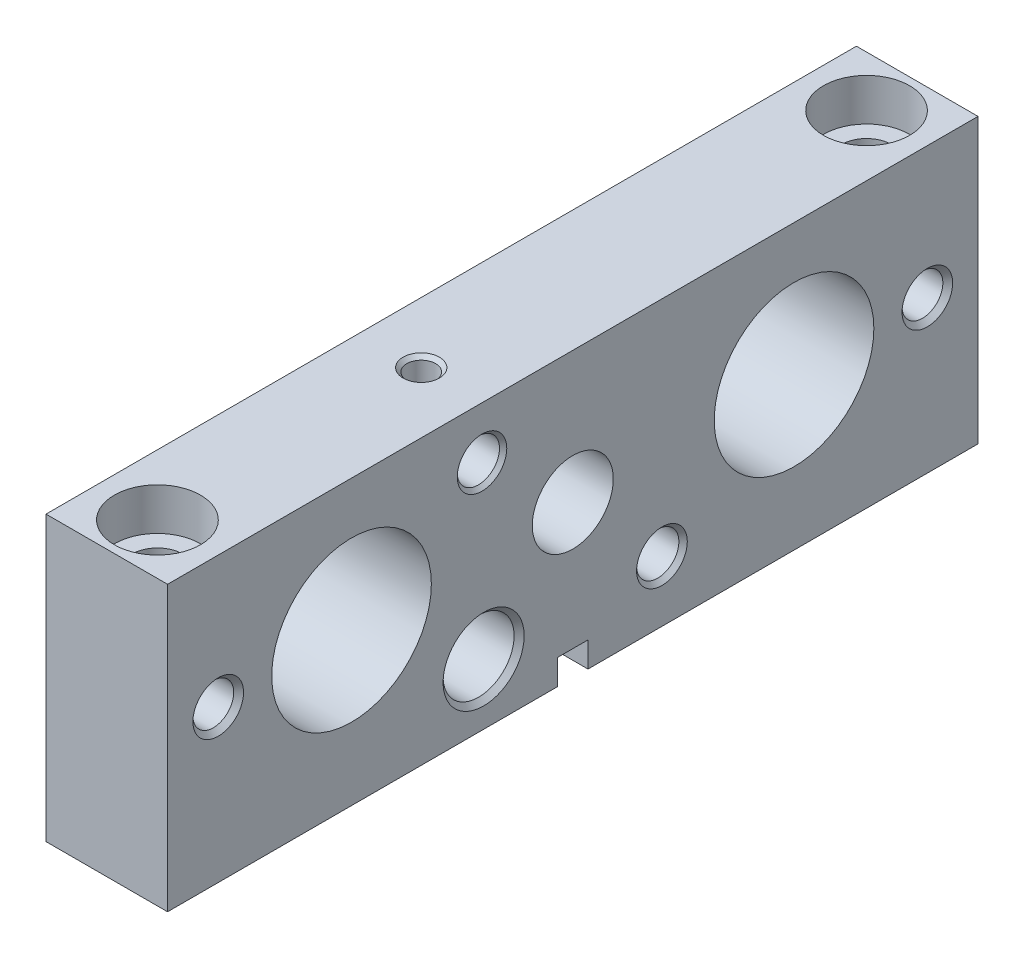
SolidWorks part; units mm, degrees
ref_plane "Front Plane" through (0, 0, 0) normal (0, 0, 1) x (1, 0, 0)
ref_plane "Top Plane" through (0, 0, 0) normal (0, 1, 0) x (1, 0, 0)
ref_plane "Right Plane" through (0, 0, 0) normal (1, 0, 0) x (0, 0, -1)
sketch "Sketch1" plane through (0, 0, 0) normal (1, 0, 0) x (0, 0, -1)
  line L0 (-63.5, -23.8252) -> (-2.3838, -23.8252)
  line L1 (-2.3838, -23.8252) -> (-2.3838, -19.8628)
  line L2 (-2.3838, -19.8628) -> (2.3838, -19.8628)
  line L3 (2.3838, -19.8628) -> (2.3838, -23.8252)
  line L4 (2.3838, -23.8252) -> (63.5, -23.8252)
  line L5 (63.5, -23.8252) -> (63.5, 20.6248)
  line L6 (63.5, 20.6248) -> (-63.5, 20.6248)
  line L7 (-63.5, 20.6248) -> (-63.5, -23.8252)
extrude "Extrude1" add sketch "Sketch1" along normal blind 19.05
ref_plane "Plane1" through (0, -23.8252, 0) normal (0, 1, 0) x (-1, 0, 0)
ref_plane "Plane2" through (0, -19.8628, 0) normal (0, 1, 0) x (-1, 0, 0)
sketch "Sketch2" plane through (0, -19.8628, 0) normal (0, 1, 0) x (-1, 0, 0)
  circle A0 centre (-9.525, 0) radius 2.3838
extrude "Cut-Extrude1" cut sketch "Sketch2" along normal blind 6.35
ref_plane "Plane3" through (0, -14.3002, 0) normal (0, 1, 0) x (-1, 0, 0)
sketch "Sketch3" plane through (0, -14.3002, 0) normal (0, 1, 0) x (-1, 0, 0)
  line L0 (-19.05, -13.97) -> (-19.05, -9.9949)
  line L1 (-19.05, -9.9949) -> (-18.3896, -10.6553)
  line L2 (-18.3896, -10.6553) -> (-0.6604, -10.6553)
  line L3 (-0.6604, -10.6553) -> (0, -9.9949)
  line L4 (0, -9.9949) -> (0, -13.97)
  line L5 (0, -13.97) -> (-19.05, -13.97)
  line L6 (0, -13.97) -> (-19.05, -13.97) construction
revolve "Cut-Revolve1" cut sketch "Sketch3" angle 360 about L6
ref_plane "Plane4" through (0, -14.3002, 0) normal (0, 1, 0) x (-1, 0, 0)
sketch "Sketch4" plane through (0, -14.3002, 0) normal (0, 1, 0) x (-1, 0, 0)
  line L0 (-19.05, 13.97) -> (-19.05, 20.32)
  line L1 (-19.05, 20.32) -> (-18.2626, 19.5326)
  line L2 (-18.2626, 19.5326) -> (-0.7874, 19.5326)
  line L3 (-0.7874, 19.5326) -> (0, 20.32)
  line L4 (0, 20.32) -> (0, 13.97)
  line L5 (0, 13.97) -> (-19.05, 13.97)
  line L6 (0, 13.97) -> (-19.05, 13.97) construction
revolve "Cut-Revolve2" cut sketch "Sketch4" angle 360 about L6
ref_plane "Plane5" through (0, 12.4968, 0) normal (0, 1, 0) x (-1, 0, 0)
sketch "Sketch5" plane through (0, 12.4968, 0) normal (0, 1, 0) x (-1, 0, 0)
  line L0 (-19.05, 14.224) -> (-19.05, 18.104)
  line L1 (-19.05, 18.104) -> (-18.4795, 17.5335)
  line L2 (-18.4795, 17.5335) -> (-0.5705, 17.5335)
  line L3 (-0.5705, 17.5335) -> (0, 18.104)
  line L4 (0, 18.104) -> (0, 14.224)
  line L5 (0, 14.224) -> (-19.05, 14.224)
  line L6 (0, 14.224) -> (-19.05, 14.224) construction
revolve "Cut-Revolve3" cut sketch "Sketch5" angle 360 about L6
ref_plane "Plane6" through (0, 0, 55.5625) normal (0, 0, 1) x (1, 0, 0)
ref_plane "Plane7" through (0, 0, -55.5625) normal (0, 0, 1) x (1, 0, 0)
sketch "Sketch6" plane through (0, 0, -55.5625) normal (0, 0, 1) x (1, 0, 0)
  line L0 (9.525, 20.6248) -> (16.2725, 20.6248)
  line L1 (16.2725, 20.6248) -> (16.2725, 14.0208)
  line L2 (16.2725, 14.0208) -> (13.4938, 14.0208)
  line L3 (13.4938, 14.0208) -> (13.4938, -23.8252)
  line L4 (13.4938, -23.8252) -> (9.525, -23.8252)
  line L5 (9.525, -23.8252) -> (9.525, 20.6248)
  line L6 (9.525, -23.8252) -> (9.525, 20.6248) construction
revolve "Cut-Revolve4" cut sketch "Sketch6" angle 360 about L6
sketch "Sketch7" plane through (0, 0, 55.5625) normal (0, 0, 1) x (1, 0, 0)
  line L0 (9.525, 20.6248) -> (16.2725, 20.6248)
  line L1 (16.2725, 20.6248) -> (16.2725, 14.0208)
  line L2 (16.2725, 14.0208) -> (13.4938, 14.0208)
  line L3 (13.4938, 14.0208) -> (13.4938, -23.8252)
  line L4 (13.4938, -23.8252) -> (9.525, -23.8252)
  line L5 (9.525, -23.8252) -> (9.525, 20.6248)
  line L6 (9.525, -23.8252) -> (9.525, 20.6248) construction
revolve "Cut-Revolve5" cut sketch "Sketch7" angle 360 about L6
ref_plane "Plane8" through (0, 0, -31.75) normal (0, 0, 1) x (1, 0, 0)
ref_plane "Plane9" through (0, 0, -25.4) normal (0, 0, 1) x (1, 0, 0)
ref_plane "Plane10" through (0, 0, 13.97) normal (0, 0, 1) x (1, 0, 0)
ref_plane "Plane11" through (0, 0, 13.4874) normal (0, 0, 1) x (1, 0, 0)
ref_plane "Plane12" through (0, 0, 14.224) normal (0, 0, 1) x (1, 0, 0)
sketch "Sketch8" plane through (0, 0, 14.224) normal (0, 0, 1) x (1, 0, 0)
  line L0 (9.525, 20.6248) -> (12.3698, 20.6248)
  line L1 (12.3698, 20.6248) -> (11.7856, 20.0406)
  line L2 (11.7856, 20.0406) -> (11.7856, 16.256)
  line L3 (11.7856, 16.256) -> (9.525, 14.9508)
  line L4 (9.525, 14.9508) -> (9.525, 20.6248)
  line L5 (9.525, 14.9508) -> (9.525, 20.6248) construction
revolve "Cut-Revolve6" cut sketch "Sketch8" angle 360 about L5
ref_plane "Plane13" through (0, 0, 0) normal (1, 0, 0) x (0, 0, -1)
ref_plane "Plane14" through (9.525, 0, 0) normal (1, 0, 0) x (0, 0, -1)
ref_plane "Plane15" through (0, 0, 0) normal (0, 1, 0) x (-1, 0, 0)
sketch "Sketch9" plane through (0, 0, 0) normal (0, 1, 0) x (-1, 0, 0)
  line L0 (-19.05, 34.671) -> (-19.05, 47.1805)
  line L1 (-19.05, 47.1805) -> (0, 47.1805)
  line L2 (0, 47.1805) -> (0, 34.671)
  line L3 (0, 34.671) -> (-19.05, 34.671)
  line L4 (0, 34.671) -> (-19.05, 34.671) construction
sketch "Sketch10" plane through (0, 0, 0) normal (0, 1, 0) x (-1, 0, 0)
  line L0 (-19.05, -34.671) -> (-19.05, -22.1615)
  line L1 (-19.05, -22.1615) -> (0, -22.1615)
  line L2 (0, -22.1615) -> (0, -34.671)
  line L3 (0, -34.671) -> (-19.05, -34.671)
  line L4 (0, -34.671) -> (-19.05, -34.671) construction
revolve "Cut-Revolve7" cut sketch "Sketch9" angle 360 about L4
revolve "Cut-Revolve8" cut sketch "Sketch10" angle 360 about L4
sketch "Sketch11" plane through (0, 0, 0) normal (0, 1, 0) x (-1, 0, 0)
  line L0 (0, 0) -> (0, -5.1318)
  line L1 (0, -5.1318) -> (-0.6004, -4.5313)
  line L2 (-0.6004, -4.5313) -> (-9.525, -4.2524)
  line L3 (-9.525, -4.2524) -> (-9.525, -6.35)
  line L4 (-9.525, -6.35) -> (-19.05, -6.35)
  line L5 (-19.05, -6.35) -> (-19.05, 0)
  line L6 (-19.05, 0) -> (0, 0)
  line L7 (-19.05, 0) -> (0, 0) construction
revolve "Cut-Revolve9" cut sketch "Sketch11" angle 360 about L7
ref_plane "Plane16" through (19.05, 0, 0) normal (1, 0, 0) x (0, 0, -1)
ref_plane "Plane17" through (19.05, 0, 0) normal (1, 0, 0) x (0, 0, -1)
ref_plane "Plane18" through (0, 0, 0) normal (1, 0, 0) x (0, 0, -1)
ref_plane "Plane19" through (0, 0, 0) normal (0, 1, 0) x (-1, 0, 0)
sketch "Sketch12" plane through (0, 0, 0) normal (0, 1, 0) x (-1, 0, 0)
  line L0 (-19.05, -55.5625) -> (-19.05, -51.5938)
  line L1 (-19.05, -51.5938) -> (-18.2816, -52.3621)
  line L2 (-18.2816, -52.3621) -> (-0.7683, -52.3621)
  line L3 (-0.7683, -52.3621) -> (0, -51.5938)
  line L4 (0, -51.5938) -> (0, -55.5625)
  line L5 (0, -55.5625) -> (-19.05, -55.5625)
  line L6 (0, -55.5625) -> (-19.05, -55.5625) construction
sketch "Sketch13" plane through (0, 0, 0) normal (0, 1, 0) x (-1, 0, 0)
  line L0 (-19.05, 55.5625) -> (-19.05, 59.5312)
  line L1 (-19.05, 59.5312) -> (-18.2816, 58.7629)
  line L2 (-18.2816, 58.7629) -> (-0.7683, 58.7629)
  line L3 (-0.7683, 58.7629) -> (0, 59.5312)
  line L4 (0, 59.5312) -> (0, 55.5625)
  line L5 (0, 55.5625) -> (-19.05, 55.5625)
  line L6 (0, 55.5625) -> (-19.05, 55.5625) construction
revolve "Cut-Revolve10" cut sketch "Sketch12" angle 360 about L6
revolve "Cut-Revolve11" cut sketch "Sketch13" angle 360 about L6
